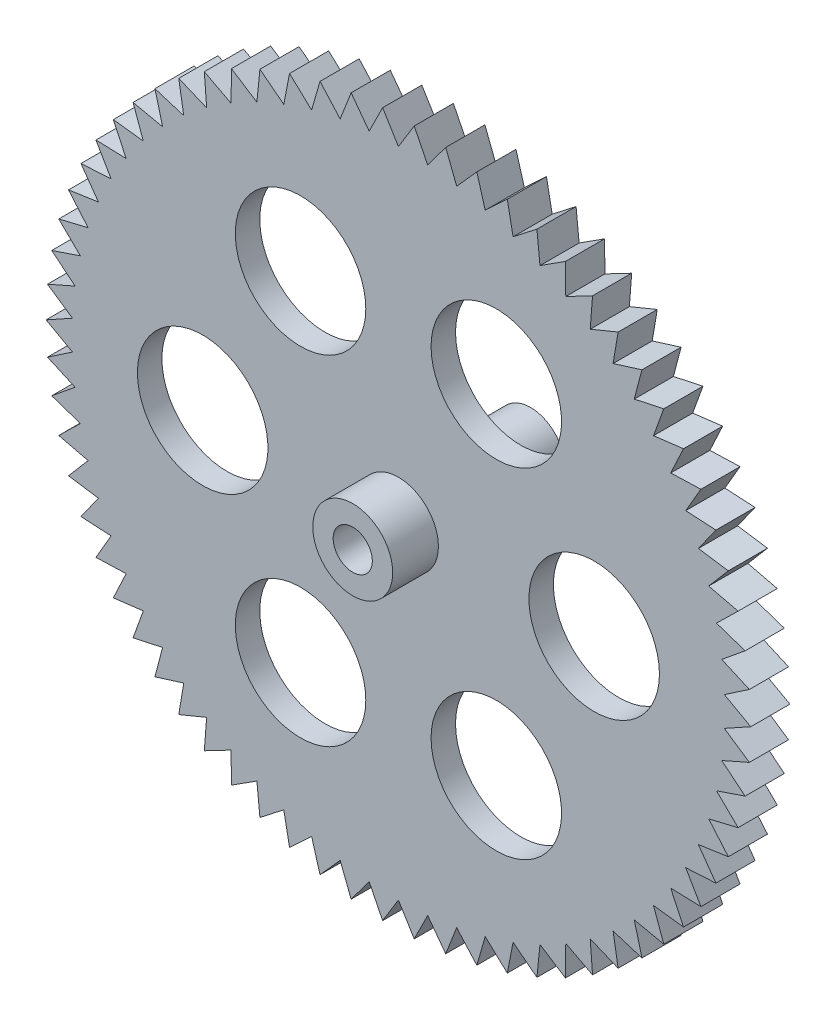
SolidWorks part; units mm, degrees
ref_plane "Face" through (0, 0, 0) normal (0, 0, 1) x (1, 0, 0)
ref_plane "Dessus" through (0, 0, 0) normal (0, 1, 0) x (1, 0, 0)
ref_plane "Droite" through (0, 0, 0) normal (1, 0, 0) x (0, 0, -1)
sketch "Esquisse1" plane through (0, 0, 0) normal (1, 0, 0) x (0, 0, -1)
  line L0 (0, 0.6) -> (0, 1.225)
  line L1 (0, 1.225) -> (1.4, 1.225)
  line L2 (1.4, 1.225) -> (1.4, 10.8)
  line L3 (1.4, 10.8) -> (2.6, 10.8)
  line L4 (2.6, 10.8) -> (2.6, 9)
  line L5 (2.6, 9) -> (2.15, 9)
  line L6 (2.15, 9) -> (2.15, 1.225)
  line L7 (2.15, 1.225) -> (2.95, 1.225)
  line L8 (2.95, 1.225) -> (2.95, 1.05)
  line L9 (2.95, 1.05) -> (5.45, 1.05)
  line L10 (5.45, 1.05) -> (5.45, 0.6)
  line L11 (5.45, 0.6) -> (0, 0.6)
  line L12 (0, 0) -> (5.45, 0) construction
  dimension "D1" = 0.6
  dimension "D2" = 0.8
  dimension "D3" = 3.3
  dimension "D4" = 0.45
  dimension "D5" = 1.2
  dimension "D6" = 9
  dimension "D7" = 1.05
  dimension "D8" = 1.225
  dimension "D9" = 10.8
  dimension "D10" = 1.4
revolve "Révolution1" add sketch "Esquisse1" angle 360 about L12
sketch "Esquisse2" plane through (0, 0, -1.4) normal (0, 0, 1) x (1, 0, 0)
  line L0 (0, 0) -> (6, 0) construction
  circle A0 centre (6, 0) radius 2
  dimension "D1" = 4
  dimension "D2" = 6
extrude "Extrusion1" cut sketch "Esquisse2" against normal through all
pattern_circular "Répétition circulaire1" count 6 over 360 about axis through (0, 0, 0) along (0, 0, 1) of "Extrusion1"
sketch "Esquisse3" plane through (0, 0, -1.4) normal (0, 0, 1) x (1, 0, 0)
  line L0 (0, 0) -> (10.8, 0) construction
  line L1 (10.8, 0) -> (0, 0) construction
  line L2 (0, 0) -> (10.7565, 0.9681) construction
  line L3 (0, 0) -> (9.9899, 0.4486) construction
  line L4 (10.8, 0) -> (9.9899, 0.4486)
  line L5 (9.9899, 0.4486) -> (10.7565, 0.9681)
  circle A1 centre (0, 0) radius 10 construction
  circle A3 centre (0, 0) radius 10.8 construction
  arc A4 (10.8, 0) -> (10.7565, 0.9681) centre (0, 0) ccw
  dimension "D2" = 20
  dimension "D1" = 5.143
  dimension "D3" = 2.571
extrude "Extrusion2" cut sketch "Esquisse3" against normal through all contours L5 L4 M8
pattern_circular "Répétition circulaire2" count 70 over 360 about axis through (0, 0, 0) along (0, 0, 1) of "Extrusion2"
